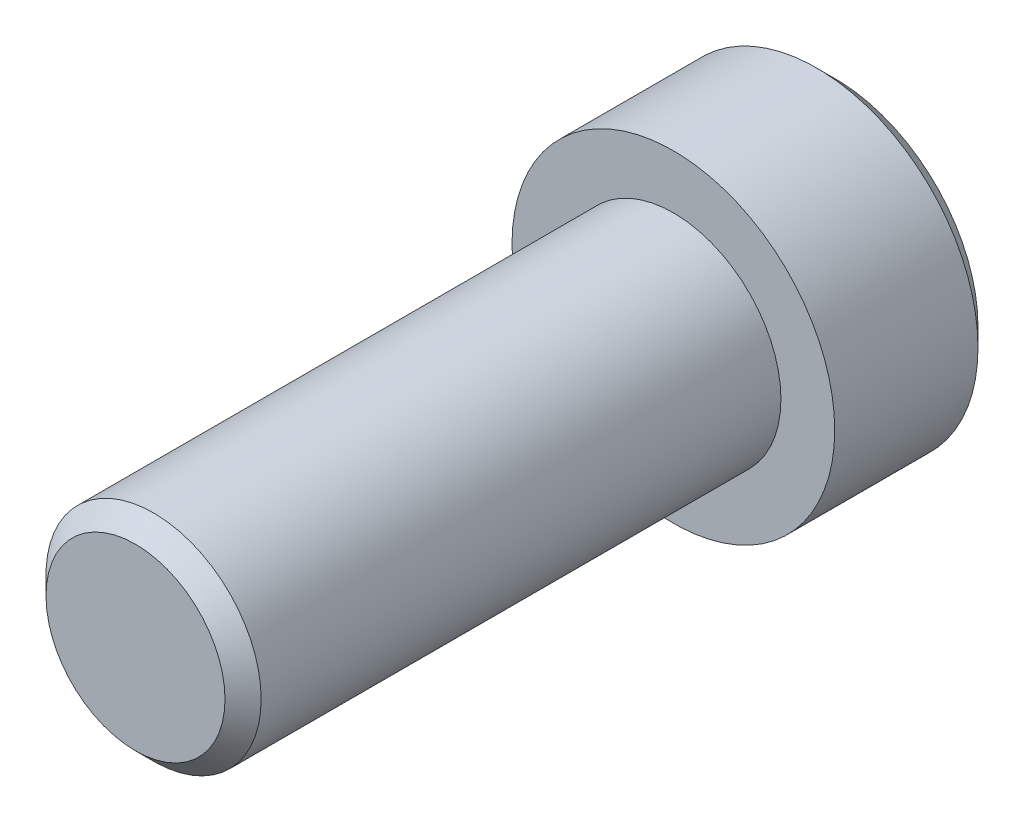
SolidWorks part; units mm, degrees
ref_plane "Front Plane" through (0, 0, 0) normal (0, 0, 1) x (1, 0, 0)
ref_plane "Top Plane" through (0, 0, 0) normal (0, 1, 0) x (1, 0, 0)
ref_plane "Right Plane" through (0, 0, 0) normal (1, 0, 0) x (0, 0, -1)
sketch "Sketch1" plane through (0, 0, 0) normal (0, 1, 0) x (1, 0, 0)
  line L0 (0, -15.875) -> (3.175, -15.875)
  line L1 (3.175, -15.875) -> (3.175, 0)
  line L2 (3.175, 0) -> (4.7625, 0)
  line L3 (4.7625, 0) -> (4.7625, 4.7625)
  line L4 (4.7625, 4.7625) -> (0, 4.7625)
  line L5 (0, -15.875) -> (0, 0)
  line L6 (0, 0) -> (0, 4.7625)
  dimension "D1" = 3.175
  dimension "D2" = 4.7625
  dimension "D3" = 4.7625
  dimension "D4" = 15.875
revolve "Revolve1" add sketch "Sketch1" angle 360 about L5
sketch "Sketch2" plane through (0, 0, -4.7625) normal (0, 0, -1) x (-1, 0, 0)
  line L1 (-2.3869, -1.365) -> (-0.0113, -2.7496)
  line L2 (-0.0113, -2.7496) -> (2.3756, -1.3846)
  line L3 (2.3756, -1.3846) -> (2.3869, 1.365)
  line L4 (2.3869, 1.365) -> (0.0113, 2.7496)
  line L5 (0.0113, 2.7496) -> (-2.3756, 1.3846)
  line L6 (-2.3756, 1.3846) -> (-2.3869, -1.365)
  circle A0 centre (0, 0) radius 2.3812 construction
  circle A1 centre (0, 0) radius 4.7625 construction
  dimension "D1" = 4.7625
extrude "Cut-Extrude1" cut sketch "Sketch2" against normal blind 4.699
chamfer "Chamfer2" distance 0.5334 angle 45 1 edges at (4.7625, 0, -4.7625)
chamfer "Chamfer3" distance 0.5334 angle 45 1 edges at (3.175, 0, 15.875)
